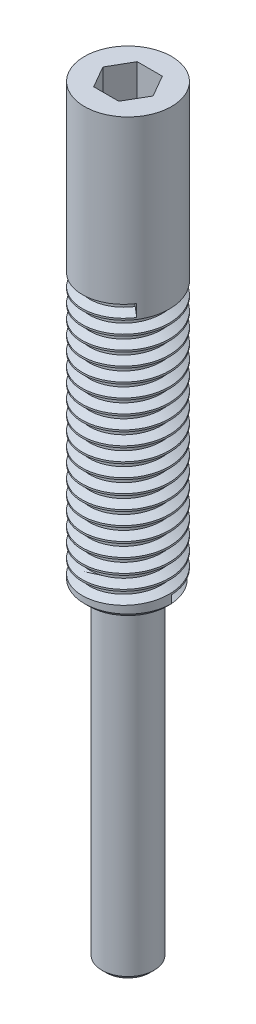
SolidWorks part; units mm, degrees
ref_plane "前视基准面" through (0, 0, 0) normal (0, 0, 1) x (1, 0, 0)
ref_plane "上视基准面" through (0, 0, 0) normal (0, 1, 0) x (1, 0, 0)
ref_plane "右视基准面" through (0, 0, 0) normal (1, 0, 0) x (0, 0, -1)
other "Configuration Table"
sketch "草图1" plane through (0, 0, 0) normal (0, 0, 1) x (1, 0, 0)
  line L0 (0, 0) -> (-1.2, 0)
  line L1 (-1.2, 0) -> (-1.2, 15)
  line L2 (-1.2, 15) -> (-2, 15)
  line L3 (-2, 15) -> (-2, 35)
  line L4 (-2, 35) -> (0, 35)
  line L5 (0, 0) -> (0, 6.9448) construction
  line L6 (0, 0) -> (0, 35)
  dimension "D1" = 1.2
  dimension "D2" = 15
  dimension "D3" = 20
  dimension "D4" = 2
revolve "旋转1" add sketch "草图1" angle 360 about L5
thread "螺纹线1" pitch 0.635 start angle 0, offset 0, length 12, pitch 0.635, diameter 4
ref_plane "基准面1" through (2, 15, 0) normal (0, 0, 1) x (1, 0, 0)
sketch "螺纹线轮廓1" plane through (2, 15, 0) normal (0, 0, 1) x (1, 0, 0)
  line L0 (0, 0) -> (0, 0.635) construction
  line L11 (0, 0) -> (0, 0.5556)
  line L12 (0, 0.5556) -> (-0.3437, 0.3572)
  line L13 (-0.3437, 0.3572) -> (-0.3437, 0.1984)
  line L15 (-0.3437, 0.1984) -> (0, 0)
  line L17 (-0.3437, 0.2778) -> (0, 0.2778) construction
  point P2 (0, 0)
  dimension "Pitch" = 0.635
  dimension "Profile_Angle" = 60
  dimension "Profile_Land" = 0.1588
  dimension "Profile_Height" = 0.3437
chamfer "倒角1" distance 0.2 angle 45 2 edges at (0, 0, -1.2) (0, 15, -2)
sketch "草图4" plane through (0, 35, 0) normal (0, 1, 0) x (1, 0, 0)
  line L1 (0.5774, 1) -> (-0.5774, 1)
  line L2 (-0.5774, 1) -> (-1.1547, 0)
  line L3 (-1.1547, 0) -> (-0.5774, -1)
  line L4 (-0.5774, -1) -> (0.5774, -1)
  line L5 (0.5774, -1) -> (1.1547, 0)
  line L6 (1.1547, 0) -> (0.5774, 1)
  circle A0 centre (0, 0) radius 1 construction
  dimension "D1" = 2
extrude "切除-拉伸1" cut sketch "草图4" against normal blind 5
